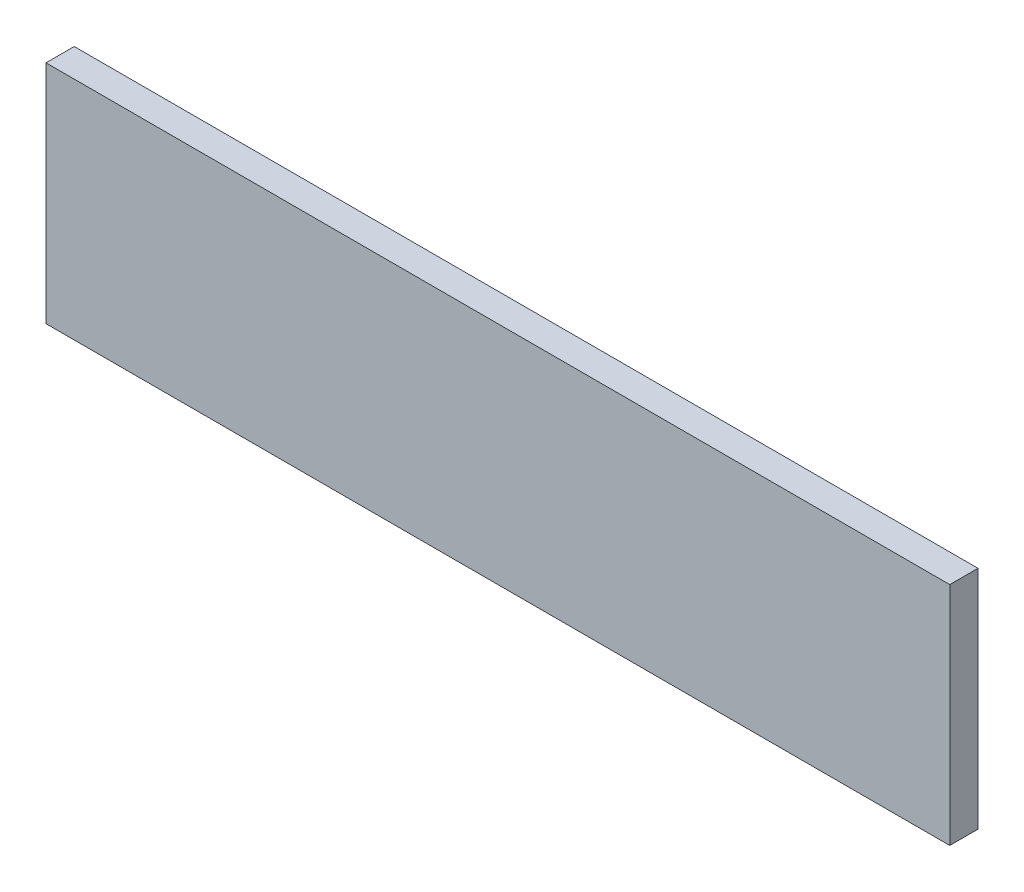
SolidWorks part; units mm, degrees
ref_plane "Front" through (0, 0, 0) normal (0, 0, 1) x (1, 0, 0)
ref_plane "Top" through (0, 0, 0) normal (0, 1, 0) x (1, 0, 0)
ref_plane "Right" through (0, 0, 0) normal (1, 0, 0) x (0, 0, -1)
sketch "Sketch1" plane through (0, 0, 0) normal (0, 0, 1) x (1, 0, 0)
  line L1 (-25.4, -6.35) -> (25.4, -6.35)
  line L2 (-25.4, -6.35) -> (-25.4, 6.35)
  line L3 (-25.4, 6.35) -> (25.4, 6.35)
  line L4 (25.4, -6.35) -> (25.4, 6.35)
  line L5 (-25.4, -6.35) -> (25.4, 6.35) construction
  line L6 (-25.4, 6.35) -> (25.4, -6.35) construction
  point P0 (0, 0)
  dimension "D1" = 50.8
  dimension "D2" = 12.7
extrude "Boss-Extrude1" add sketch "Sketch1" along normal blind 1.5875
